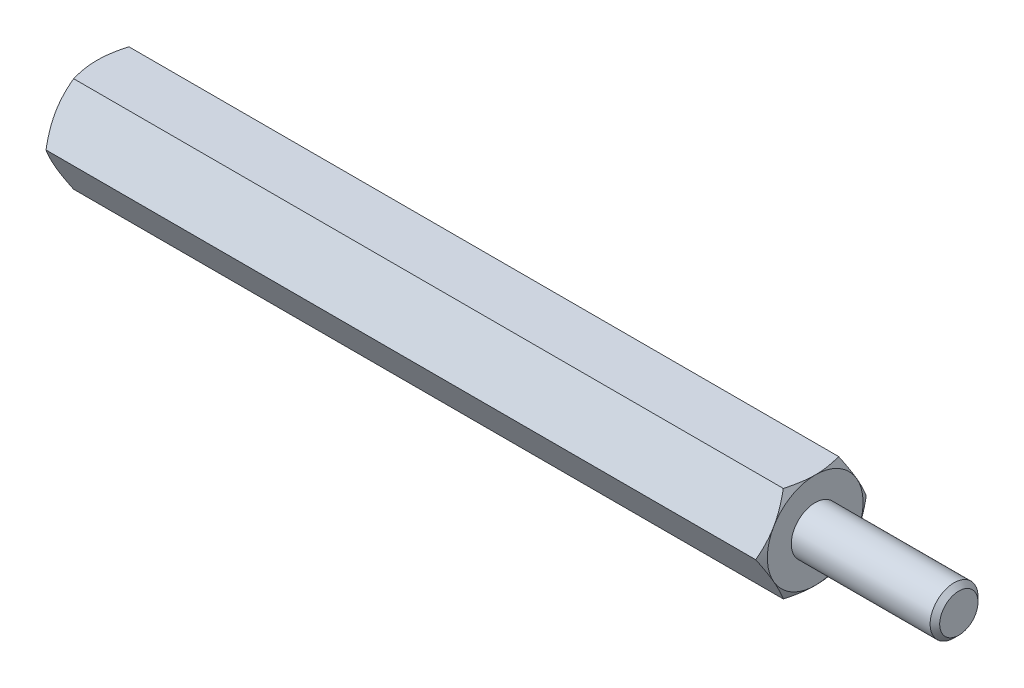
SolidWorks part; units mm, degrees
ref_plane "Front Plane" through (0, 0, 0) normal (0, 0, 1) x (1, 0, 0)
ref_plane "Top Plane" through (0, 0, 0) normal (0, 1, 0) x (1, 0, 0)
ref_plane "Right Plane" through (0, 0, 0) normal (1, 0, 0) x (0, 0, -1)
sketch "Sketch1" plane through (0, 0, 0) normal (1, 0, 0) x (0, 0, -1)
  line L1 (1.1547, 2) -> (-1.1547, 2)
  line L2 (-1.1547, 2) -> (-2.3094, 0)
  line L3 (-2.3094, 0) -> (-1.1547, -2)
  line L4 (-1.1547, -2) -> (1.1547, -2)
  line L5 (1.1547, -2) -> (2.3094, 0)
  line L6 (2.3094, 0) -> (1.1547, 2)
  circle A0 centre (0, 0) radius 2 construction
  dimension "D1" = 4
extrude "Extrude2" add sketch "Sketch1" along normal mid plane 30
sketch "Sketch2" plane through (0, 0, 0) normal (0, 0, 1) x (1, 0, 0)
  line L0 (-15, 2) -> (-13.5, 4.5981)
  line L1 (-15, 5) -> (-15, 2)
  line L3 (0, 0) -> (50000, 0) construction
  arc A0 (-13.5, 4.5981) -> (-15, 5) centre (-14.1962, 5) ccw
  dimension "D1" = 30
  dimension "D2" = 3
revolve "Cut-Revolve1" cut sketch "Sketch2" angle 360 about L3
mirror "Mirror1" about plane through (0, 0, 0) normal (1, 0, 0) of "Cut-Revolve1"
sketch "Sketch3" plane through (-15, 0, 0) normal (-1, 0, 0) x (0, 0, 1)
  circle A0 centre (0, 0) radius 0.8
  dimension "D1" = 1.6
extrude "Extrude3" cut sketch "Sketch3" against normal blind 6
sketch "Sketch4" plane through (0, 0, 0) normal (0, 0, 1) x (1, 0, 0)
  line L0 (-9, 0) -> (-9, 0.8)
  line L1 (14.8214, 0) -> (-14.8214, 0) construction
  line L2 (-9, 0.8) -> (-8.5381, 0)
  line L3 (-8.5381, 0) -> (-9, 0)
  line L4 (-15, 1) -> (-15, -1) construction
  point P4 (-15, 0)
  dimension "D1" = 30
  dimension "D2" = 0.8
  dimension "D3" = 6
revolve "Cut-Revolve2" cut sketch "Sketch4" angle 360 about L3
sketch "Sketch5" plane through (15, 0, 0) normal (1, 0, 0) x (0, 0, -1)
  circle A0 centre (0, 0) radius 1
  dimension "D1" = 2
extrude "Extrude4" add sketch "Sketch5" along normal blind 6
chamfer "Chamfer1" distance 0.2 angle 45 1 edges at (21, 0, -1)
equation "\"D2@Sketch4\" = \"D1@Sketch3\"/2"
